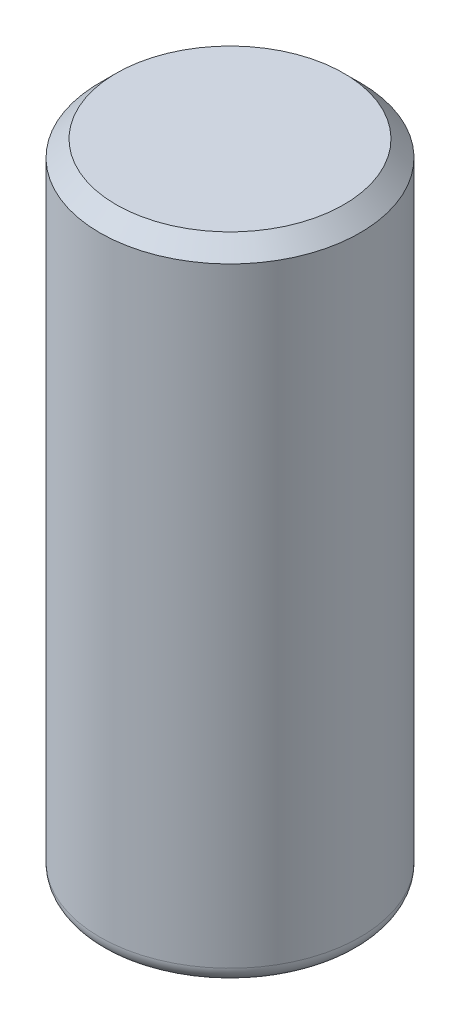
SolidWorks part; units mm, degrees
ref_plane "Front Plane" through (0, 0, 0) normal (0, 0, 1) x (1, 0, 0)
ref_plane "Top Plane" through (0, 0, 0) normal (0, 1, 0) x (1, 0, 0)
ref_plane "Right Plane" through (0, 0, 0) normal (1, 0, 0) x (0, 0, -1)
sketch "Sketch1" plane through (0, 0, 0) normal (0, 0, 1) x (1, 0, 0)
  line L0 (0, 0) -> (-2.032, 0)
  line L1 (-2.032, 0) -> (-2.032, 10.033)
  line L2 (-2.032, 10.033) -> (0, 10.033)
  line L3 (0, 10.033) -> (0, 0)
  line L4 (0, 7.983) -> (0, -2.451) construction
  dimension "D1" = 4.064
  dimension "D2" = 10.033
revolve "Revolve1" add sketch "Sketch1" angle 360 about L4
fillet "Fillet1" radius 0.254 1 edges at (0, 0, 2.032)
chamfer "Chamfer1" distance 0.254 angle 45 1 edges at (0, 10.033, 2.032)
